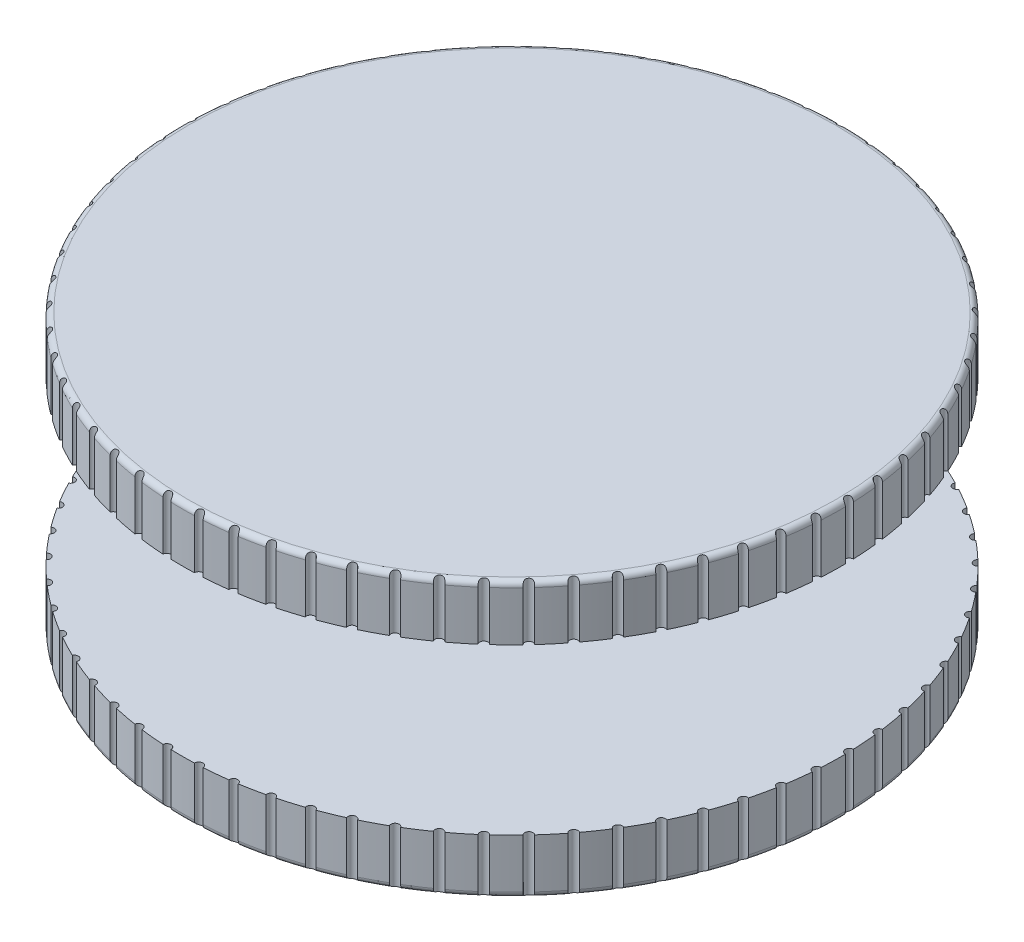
SolidWorks part; units mm, degrees
ref_plane "Front Plane" through (0, 0, 0) normal (0, 0, 1) x (1, 0, 0)
ref_plane "Top Plane" through (0, 0, 0) normal (0, 1, 0) x (1, 0, 0)
ref_plane "Right Plane" through (0, 0, 0) normal (1, 0, 0) x (0, 0, -1)
sketch "Sketch1" plane through (0, 0, 0) normal (0, 0, 1) x (1, 0, 0)
  line L0 (0, 8.3822) -> (0, -3.6625) construction
  line L1 (0, 0) -> (-1, 0)
  line L2 (-1, 0) -> (-1, 1.5)
  line L3 (-1, 1.5) -> (-6, 1.5)
  line L4 (-6, 1.5) -> (-6, 2.5)
  line L5 (-6, 2.5) -> (0, 2.5)
  line L6 (0, 2.5) -> (0, 0)
  dimension "D1" = 2
  dimension "D2" = 1.5
  dimension "D3" = 1
  dimension "D4" = 6
revolve "Revolve1" add sketch "Sketch1" angle 360 about L0
mirror "Mirror1" about plane through (0, 0, 0) normal (0, -1, 0) of "Revolve1"
fillet "Fillet1" radius 0.1 2 edges at (0, -2.5, 6) (0, 2.5, 6)
sketch "Sketch3" plane through (0, 2.5, 0) normal (0, 1, 0) x (1, 0, 0)
  line L0 (0, 6) -> (0, 0) construction
  line L1 (0, 0) -> (-5.9563, 0.7232) construction
  circle A0 centre (0, 6) radius 0.075
  circle A1 centre (0, 0) radius 6 construction
  circle A2 centre (0, 0) radius 6 construction
  circle A3 centre (0.5791, 5.972) radius 0.075
  circle A4 centre (1.1528, 5.8882) radius 0.075
  circle A5 centre (1.7157, 5.7495) radius 0.075
  circle A6 centre (2.2626, 5.557) radius 0.075
  circle A7 centre (2.7883, 5.3127) radius 0.075
  circle A8 centre (3.2881, 5.0188) radius 0.075
  circle A9 centre (3.7571, 4.678) radius 0.075
  circle A10 centre (4.1911, 4.2936) radius 0.075
  circle A11 centre (4.5859, 3.8691) radius 0.075
  circle A12 centre (4.9379, 3.4084) radius 0.075
  circle A13 centre (5.2438, 2.9159) radius 0.075
  circle A14 centre (5.5008, 2.3962) radius 0.075
  circle A15 centre (5.7063, 1.8541) radius 0.075
  circle A16 centre (5.8586, 1.2947) radius 0.075
  circle A17 centre (5.9563, 0.7232) radius 0.075
  circle A18 centre (5.9982, 0.145) radius 0.075
  circle A19 centre (5.9842, -0.4346) radius 0.075
  circle A20 centre (5.9144, -1.0101) radius 0.075
  circle A21 centre (5.7893, -1.5762) radius 0.075
  circle A22 centre (5.6101, -2.1276) radius 0.075
  circle A23 centre (5.3786, -2.6591) radius 0.075
  circle A24 centre (5.0968, -3.1658) radius 0.075
  circle A25 centre (4.7675, -3.643) radius 0.075
  circle A26 centre (4.3936, -4.0861) radius 0.075
  circle A27 centre (3.9787, -4.4911) radius 0.075
  circle A28 centre (3.5267, -4.8541) radius 0.075
  circle A29 centre (3.0418, -5.1718) radius 0.075
  circle A30 centre (2.5284, -5.4412) radius 0.075
  circle A31 centre (1.9914, -5.6599) radius 0.075
  circle A32 centre (1.4359, -5.8257) radius 0.075
  circle A33 centre (0.8669, -5.937) radius 0.075
  circle A34 centre (0.2899, -5.993) radius 0.075
  circle A35 centre (-0.2899, -5.993) radius 0.075
  circle A36 centre (-0.8669, -5.937) radius 0.075
  circle A37 centre (-1.4359, -5.8257) radius 0.075
  circle A38 centre (-1.9914, -5.6599) radius 0.075
  circle A39 centre (-2.5284, -5.4412) radius 0.075
  circle A40 centre (-3.0418, -5.1718) radius 0.075
  circle A41 centre (-3.5267, -4.8541) radius 0.075
  circle A42 centre (-3.9787, -4.4911) radius 0.075
  circle A43 centre (-4.3936, -4.0861) radius 0.075
  circle A44 centre (-4.7675, -3.643) radius 0.075
  circle A45 centre (-5.0968, -3.1658) radius 0.075
  circle A46 centre (-5.3786, -2.6591) radius 0.075
  circle A47 centre (-5.6101, -2.1276) radius 0.075
  circle A48 centre (-5.7893, -1.5762) radius 0.075
  circle A49 centre (-5.9144, -1.0101) radius 0.075
  circle A50 centre (-5.9842, -0.4346) radius 0.075
  circle A51 centre (-5.9982, 0.145) radius 0.075
  circle A52 centre (-5.9563, 0.7232) radius 0.075
  circle A53 centre (-5.8586, 1.2947) radius 0.075
  circle A54 centre (-5.7063, 1.8541) radius 0.075
  circle A55 centre (-5.5008, 2.3962) radius 0.075
  circle A56 centre (-5.2438, 2.9159) radius 0.075
  circle A57 centre (-4.9379, 3.4084) radius 0.075
  circle A58 centre (-4.5859, 3.8691) radius 0.075
  circle A59 centre (-4.1911, 4.2936) radius 0.075
  circle A60 centre (-3.7571, 4.678) radius 0.075
  circle A61 centre (-3.2881, 5.0188) radius 0.075
  circle A62 centre (-2.7883, 5.3127) radius 0.075
  circle A63 centre (-2.2626, 5.557) radius 0.075
  circle A64 centre (-1.7157, 5.7495) radius 0.075
  circle A65 centre (-1.1528, 5.8882) radius 0.075
  circle A66 centre (-0.5791, 5.972) radius 0.075
  point P137 (0, 0)
  dimension "D1" = 0.15
  dimension "D3" = 83.077
  dimension "D2" = 65
extrude "Cut-Extrude3" cut sketch "Sketch3" against normal through all
